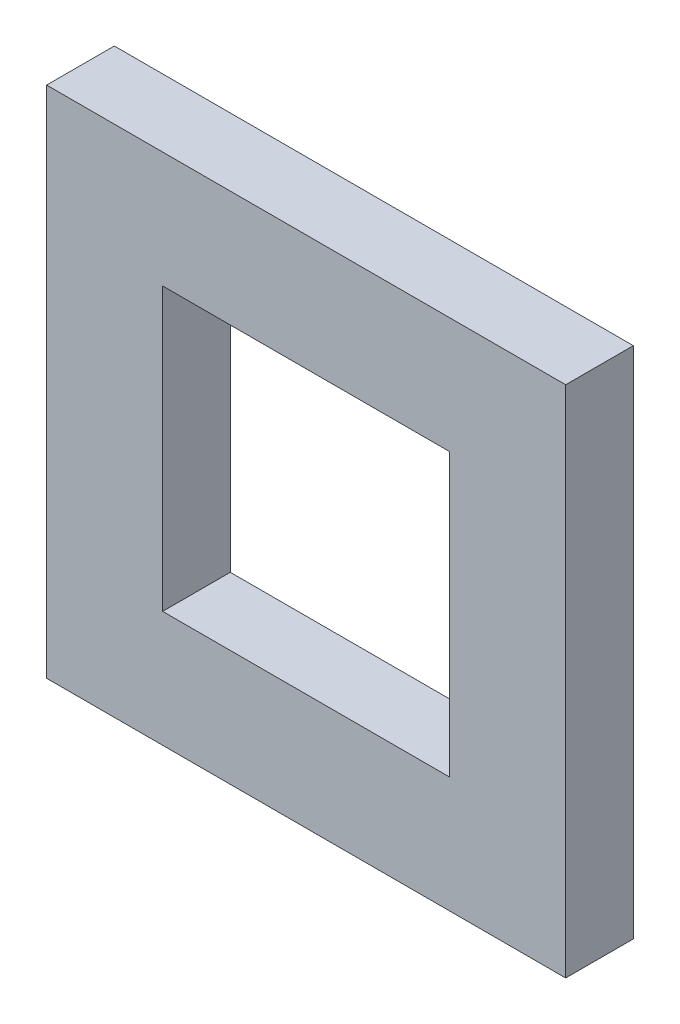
SolidWorks part; units mm, degrees
ref_plane "Front Plane" through (0, 0, 0) normal (0, 0, 1) x (1, 0, 0)
ref_plane "Top Plane" through (0, 0, 0) normal (0, 1, 0) x (1, 0, 0)
ref_plane "Right Plane" through (0, 0, 0) normal (1, 0, 0) x (0, 0, -1)
sketch "Sketch1" plane through (0, 0, 0) normal (0, 0, 1) x (1, 0, 0)
  line L0 (-85.2551, 84.3915) -> (85.2551, 84.3915)
  line L1 (-66.2051, 65.3415) -> (66.2051, 65.3415) construction
  line L2 (-66.2051, 65.3415) -> (-66.2051, -65.3415) construction
  line L3 (-66.2051, -65.3415) -> (66.2051, -65.3415) construction
  line L4 (66.2051, 65.3415) -> (66.2051, -65.3415) construction
  line L5 (-66.2051, 65.3415) -> (66.2051, -65.3415) construction
  line L6 (-66.2051, -65.3415) -> (66.2051, 65.3415) construction
  line L7 (85.2551, 84.3915) -> (85.2551, -84.3915)
  line L8 (-85.2551, -84.3915) -> (85.2551, -84.3915)
  line L9 (-85.2551, 84.3915) -> (-85.2551, -84.3915)
  line L10 (-47.1551, 46.2915) -> (-47.1551, -46.2915)
  line L11 (-47.1551, -46.2915) -> (47.1551, -46.2915)
  line L12 (47.1551, 46.2915) -> (47.1551, -46.2915)
  line L13 (-47.1551, 46.2915) -> (47.1551, 46.2915)
  point P0 (0, 0)
  dimension "D1" = 132.4102
  dimension "D2" = 130.683
  dimension "D3" = 19.05
  dimension "D4" = 19.05
extrude "Boss-Extrude1" add sketch "Sketch1" along normal blind 22.225
